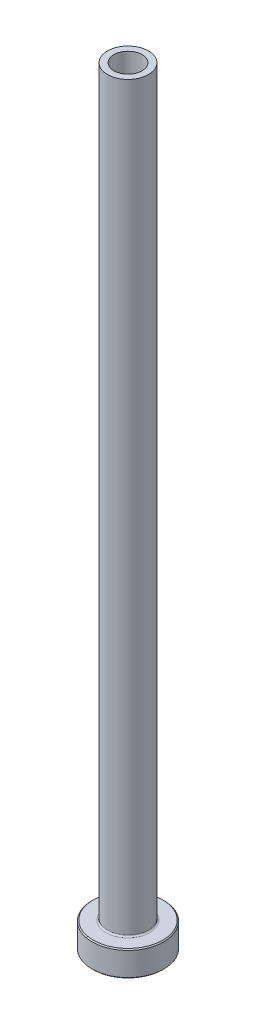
SolidWorks part; units mm, degrees
ref_plane "Front Plane" through (0, 0, 0) normal (0, 0, 1) x (1, 0, 0)
ref_plane "Top Plane" through (0, 0, 0) normal (0, 1, 0) x (1, 0, 0)
ref_plane "Right Plane" through (0, 0, 0) normal (1, 0, 0) x (0, 0, -1)
sketch "Sketch1" plane through (0, 0, 0) normal (0, 0, 1) x (1, 0, 0)
  line L0 (-2.75, 150) -> (-4, 150)
  line L1 (-4, 150) -> (-4, 5)
  line L2 (-4, 5) -> (-7, 5)
  line L3 (-7, 5) -> (-7, 0)
  line L4 (7.7, 0) -> (-7.7, 0) construction
  line L5 (-7, 0) -> (-3, 0)
  line L6 (-2.75, 105) -> (-2.75, 150)
  line L7 (0, 92.1877) -> (0, -15.5353) construction
  line L8 (0, -7.7) -> (0, 7.7) construction
  line L9 (-2.75, 105) -> (-3, 93)
  line L10 (-3, 93) -> (-3, 0)
  dimension "D1" = 0.25
  dimension "ID" = 5.5
  dimension "OD" = 8
  dimension "L" = 150
  dimension "H" = 14
  dimension "T" = 5
  dimension "N" = 45
  dimension "D2" = 12
revolve "Revolve1" add sketch "Sketch1" angle 360 about L7
fillet "Fillet1" radius 0.3 1 edges at (0, 5, 4)
chamfer "Chamfer1" distance 0.2 angle 45 2 edges at (0, 5, 7) (0, 0, 7)
chamfer "Chamfer3" distance 0.5 angle 45 1 edges at (0, 0, 3)
